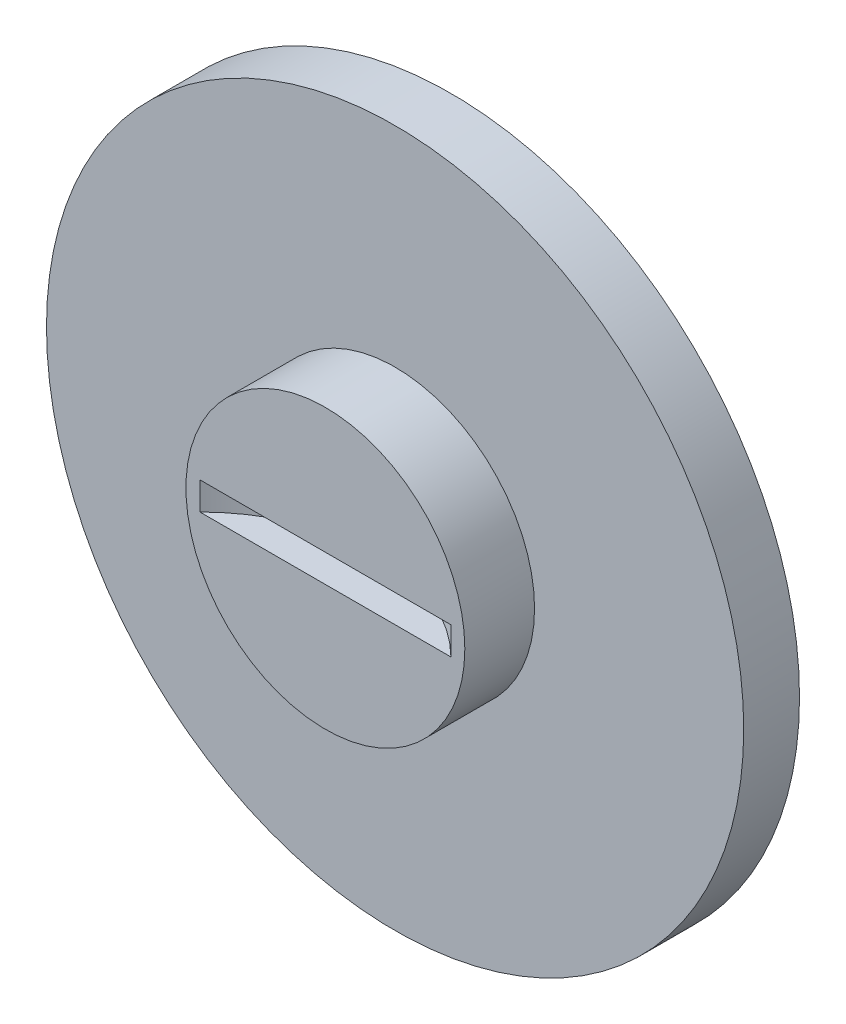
SolidWorks part; units mm, degrees
ref_plane "Front Plane" through (0, 0, 0) normal (0, 0, 1) x (1, 0, 0)
ref_plane "Top Plane" through (0, 0, 0) normal (0, 1, 0) x (1, 0, 0)
ref_plane "Right Plane" through (0, 0, 0) normal (1, 0, 0) x (0, 0, -1)
sketch "Sketch1" plane through (0, 0, 0) normal (0, 0, 1) x (1, 0, 0)
  circle A0 centre (0, 0) radius 25
extrude "Boss-Extrude1" add sketch "Sketch1" against normal blind 4
sketch "Sketch3" plane through (0, 0, 0) normal (0, 0, 1) x (1, 0, 0)
  circle A0 centre (0, 0) radius 10
extrude "Boss-Extrude2" add sketch "Sketch3" along normal blind 5
sketch "Sketch4" plane through (0, 0, 0) normal (0, 1, 0) x (1, 0, 0)
  line L0 (-10, -5) -> (-9, -5) construction
  line L1 (-10, -5) -> (10, -5) construction
  line L2 (10, -5) -> (9, -5) construction
  line L5 (-9, -5) -> (-9, -8.3454)
  line L6 (-9, -8.3454) -> (9, -8.3454)
  line L7 (9, -5) -> (9, -8.3454)
  arc A0 (-9, -5) -> (9, -5) centre (0, -14) cw
extrude "Cut-Extrude1" cut sketch "Sketch4" against normal mid plane 2
sketch "Sketch2" plane through (0, 0, 0) normal (1, 0, 0) x (0, 0, -1)
  line L0 (-25, 0) -> (0, 0)
  line L1 (-22, 10) -> (-22, 9)
  line L3 (0, 0) -> (0, 9)
  line L4 (0, 9) -> (-4, 9)
  line L7 (-4, 9) -> (-4, 10)
  line L8 (-4, 10) -> (-22, 10)
  line L12 (-22, 9) -> (-25, 9)
  line L13 (-25, 0) -> (-25, 9)
  dimension "D1" = 4
  dimension "D3" = 18
  dimension "D5" = 3
  dimension "D6" = 9
revolve "Revolve1" [suppressed] add sketch "Sketch2" angle 360 about L0
